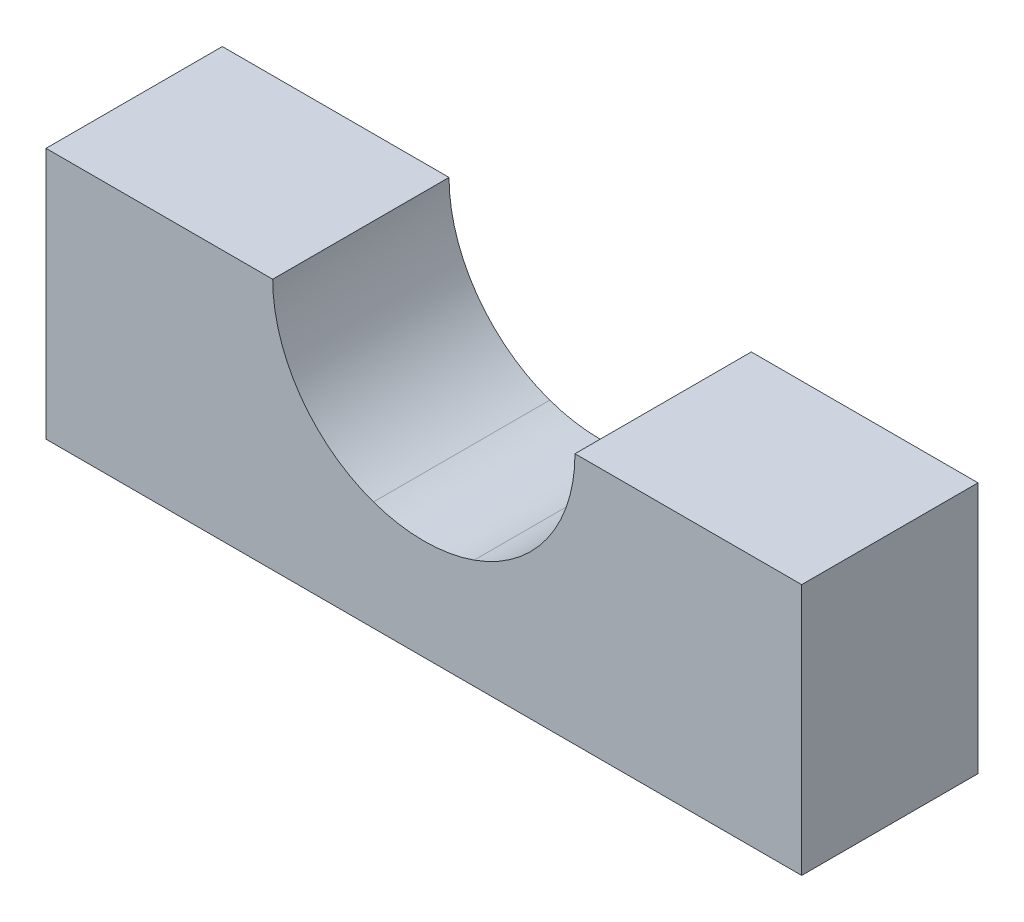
SolidWorks part; units mm, degrees
ref_plane "Front" through (0, 0, 0) normal (0, 0, 1) x (1, 0, 0)
ref_plane "Top" through (0, 0, 0) normal (0, 1, 0) x (1, 0, 0)
ref_plane "Right" through (0, 0, 0) normal (1, 0, 0) x (0, 0, -1)
sketch "Sketch1" plane through (0, 0, 0) normal (0, 0, 1) x (1, 0, 0)
  line L1 (0, 0) -> (300, 0)
  line L2 (0, 0) -> (0, 100)
  line L3 (0, 100) -> (300, 100)
  line L4 (300, 0) -> (300, 100)
  dimension "D1" = 300
  dimension "D2" = 100
extrude "Extrude1" add sketch "Sketch1" along normal blind 70
sketch "Sketch2" plane through (0, 0, 70) normal (0, 0, 1) x (1, 0, 0)
  line L0 (150, 164.4547) -> (150, -71.6564) construction
  line L1 (0, 100) -> (0, 0) construction
  line L2 (300, 100) -> (0, 100) construction
  line L3 (210, 100) -> (90, 100)
  arc A0 (90, 100) -> (210, 100) centre (150, 100) ccw
  dimension "D2" = 60
  dimension "D1" = 150
extrude "Cut-Extrude1" cut sketch "Sketch2" against normal through all
sketch "Sketch3" plane through (0, 100, 0) normal (0, 1, 0) x (-1, 0, 0)
  line L0 (-170, 0) -> (-170, 70)
  line L1 (-210, 0) -> (-90, 0) construction
  line L2 (-90, 70) -> (-210, 70) construction
  line L4 (-150, -111.4536) -> (-150, 150.1658) construction
  line L5 (-300, 70) -> (-300, 0) construction
  line L6 (-130, 0) -> (-130, 70)
  line L7 (-170, 0) -> (-130, 0)
  line L8 (-170, 70) -> (-130, 70)
  dimension "D1" = 40
  dimension "D2" = 150
sketch "Sketch4" plane through (0, 100, 0) normal (0, 1, 0) x (-1, 0, 0)
  line L0 (-334.7313, 0) -> (34.7313, 0) construction
  line L1 (-300, 0) -> (-210, 0) construction
  line L2 (-150, -93.6715) -> (-150, 209.7485) construction
  line L4 (0, 70) -> (0, 0) construction
  point P8 (-150, 0)
  dimension "D1" = 150
